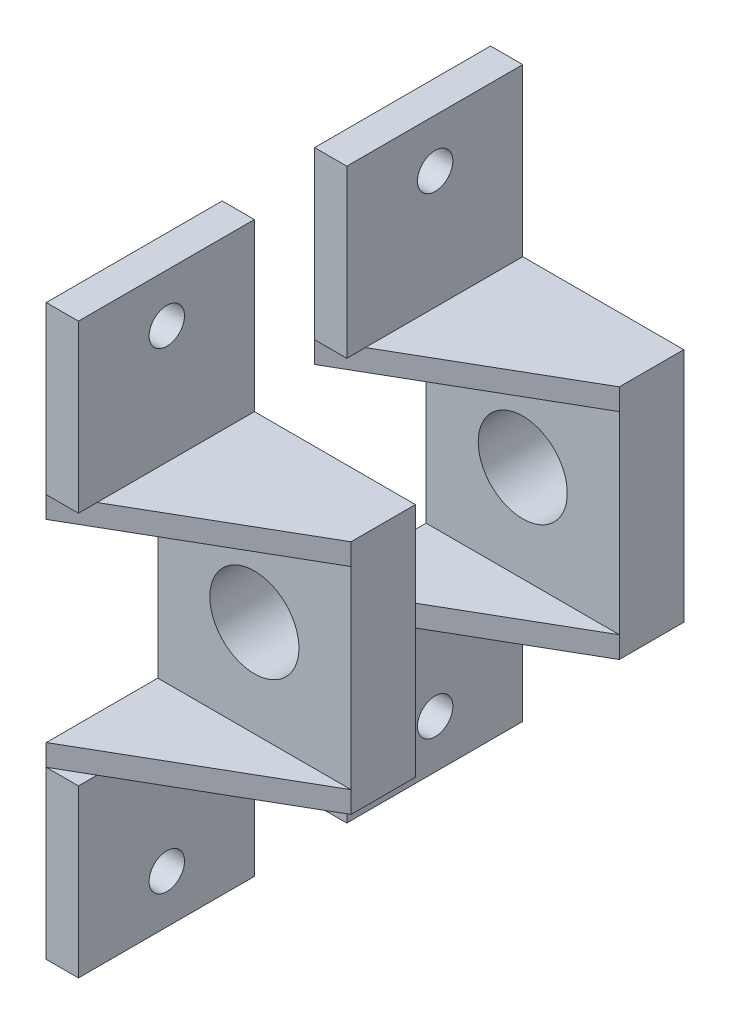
SolidWorks part; units mm, degrees
ref_plane "Alzado" through (0, 0, 0) normal (0, 0, 1) x (1, 0, 0)
ref_plane "Planta" through (0, 0, 0) normal (0, 1, 0) x (1, 0, 0)
ref_plane "Vista lateral" through (0, 0, 0) normal (1, 0, 0) x (0, 0, -1)
sketch "Croquis1" plane through (0, 0, 0) normal (1, 0, 0) x (0, 0, -1)
  line L0 (-1, 0) -> (-1, 12.3829) construction
  line L5 (-124.75, -85.2098) -> (150.75, -85.2098)
  line L6 (-124.75, -85.2098) -> (-124.75, 114.7902)
  line L7 (-124.75, 114.7902) -> (150.75, 114.7902)
  line L8 (150.75, -85.2098) -> (150.75, 114.7902)
  line L9 (-124.75, -85.2098) -> (150.75, 114.7902) construction
  line L10 (-124.75, 114.7902) -> (150.75, -85.2098) construction
  line L11 (93, 15.25) -> (60.5, 15.25)
  line L13 (93, -15.25) -> (60.5, -15.25)
  line L15 (76.75, -14.4007) -> (76.75, -9.0223) construction
  line L16 (-1, 0) -> (8.5392, 0) construction
  line L21 (13, 114.7902) -> (13, 58.1657) construction
  line L35 (13, 14.7902) -> (13, 48) construction
  line L38 (93, 25.25) -> (60.5, 25.25) construction
  line L39 (93, -25.25) -> (60.5, -25.25) construction
  line L40 (-64.5, 25) -> (-64.5, 58) construction
  line L43 (-64.5, 38) -> (77.5, 38)
  line L44 (-64.5, 38) -> (-64.5, 78)
  line L45 (-64.5, 78) -> (77.5, 78)
  line L46 (77.5, 38) -> (77.5, 78)
  line L47 (-73, 78) -> (-73, 38)
  line L48 (-69.5, 78) -> (-69.5, 38)
  line L49 (86, 78) -> (86, 38)
  line L50 (82.5, 78) -> (82.5, 38)
  line L51 (-64.5, -25) -> (-64.5, -58) construction
  line L52 (-124.75, 14.7902) -> (-97.6875, 14.7902) construction
  line L53 (45.5, 17) -> (-48.6148, 17)
  line L54 (45.5, 13.7) -> (-48.6148, 13.7)
  arc A0 (93, -15.25) -> (93, 15.25) centre (93, 0) ccw
  arc A1 (60.5, -15.25) -> (60.5, 15.25) centre (60.5, 0) cw
  circle A2 centre (-64.5, 0) radius 15.25
  circle A5 centre (-64.5, 0) radius 25 construction
  arc A6 (60.5, -25.25) -> (60.5, 25.25) centre (60.5, 0) cw construction
  arc A7 (93, -25.25) -> (93, 25.25) centre (93, 0) ccw construction
  arc A8 (-69.5, 78) -> (-73, 78) centre (-71.25, 78) ccw
  arc A9 (-73, 38) -> (-69.5, 38) centre (-71.25, 38) ccw
  arc A10 (82.5, 38) -> (86, 38) centre (84.25, 38) ccw
  arc A11 (86, 78) -> (82.5, 78) centre (84.25, 78) ccw
  circle A12 centre (138.75, 109.7902) radius 1.75
  circle A13 centre (-112.75, 109.7902) radius 1.75
  circle A14 centre (138.75, -80.2098) radius 1.75
  circle A15 centre (-112.75, -80.2098) radius 1.75
  arc A16 (45.5, 13.7) -> (45.5, 17) centre (45.5, 15.35) ccw
  arc A17 (-48.6148, 17) -> (-48.6148, 13.7) centre (-48.6148, 15.35) ccw
  point P0 (0, 0)
  point P16 (76.75, 15.25)
  point P18 (76.75, -15.25)
  point P22 (108.25, 0)
  point P31 (13, 55.8)
  point P33 (13, 65.25)
  dimension "D5" = 30.5
  dimension "D10" = 30.5
  dimension "D8" = 45
  dimension "D9" = 142
  dimension "D11" = 40
  dimension "D14" = 50
  dimension "D13" = 3.5
  dimension "D17" = 3.5
  dimension "D23" = 3.5
  dimension "D26" = 3.3
  dimension "D29" = 3.3
  dimension "D2" = 200
  dimension "D3" = 125
  dimension "D4" = 64.5
  dimension "D6" = 16.25
  dimension "D7" = 42.5
  dimension "D12" = 20
  dimension "D16" = 33
  dimension "D18" = 40
  dimension "D19" = 5
  dimension "D20" = 2
  dimension "D21" = 5
  dimension "D22" = 33
  dimension "D24" = 12
  dimension "D25" = 5
  dimension "D27" = 21
  dimension "D28" = 15
  dimension "D15" = 10
extrude "Saliente-Extruir1" add sketch "Croquis1" along normal blind 6
ref_plane "Plano4" through (6, 0, 0) normal (1, 0, 0) x (0, 0, -1)
sketch "Croquis2" plane through (6, 0, 0) normal (1, 0, 0) x (0, 0, -1)
  line L1 (8, -11) -> (2, -11)
  line L2 (8, -11) -> (8, 11)
  line L3 (8, 11) -> (2, 11)
  line L4 (2, -11) -> (2, 11)
  line L5 (8, -11) -> (2, 11) construction
  line L6 (8, 11) -> (2, -11) construction
  point P0 (5, 0)
  dimension "D1" = 6
  dimension "D2" = 22
  dimension "D3" = 5
extrude "Saliente-Extruir2" add sketch "Croquis2" along normal blind 18
ref_plane "Plano5" through (0, 11, 0) normal (0, 1, 0) x (1, 0, 0)
sketch "Croquis3" plane through (0, 11, 0) normal (0, 1, 0) x (1, 0, 0)
  line L0 (6, -8.3923) -> (24, 2)
  line L1 (6, -60.9824) -> (6, 60.9824) construction
  line L2 (24, 2) -> (6, 2)
  line L3 (6, 2) -> (6, -8.3923)
  dimension "D1" = 60
extrude "Saliente-Extruir3" add sketch "Croquis3" against normal blind 2
ref_plane "Plano6" through (0, -11, 0) normal (0, -1, 0) x (-1, 0, 0)
sketch "Croquis4" plane through (0, -11, 0) normal (0, -1, 0) x (-1, 0, 0)
  line L0 (-24, 2) -> (-6, -8.3923)
  line L1 (-6, 60.9824) -> (-6, -60.9824) construction
  line L2 (-6, -8.3923) -> (-24, 2) construction
  line L3 (-6, -8.3923) -> (-6, 2)
  line L4 (-24, 2) -> (-6, 2) construction
  line L5 (-6, 2) -> (-24, 2)
extrude "Saliente-Extruir4" add sketch "Croquis4" against normal blind 2
ref_plane "Plano7" through (0, 0, -8) normal (0, 0, -1) x (-1, 0, 0)
sketch "Croquis5" plane through (0, 0, -8) normal (0, 0, -1) x (-1, 0, 0)
  line L2 (-6, 60.9824) -> (-6, -60.9824) construction
  circle A0 centre (-15, 0) radius 4.15
  dimension "D2" = 8.3
  dimension "D1" = 9
extrude "Cortar-Extruir1" cut sketch "Croquis5" against normal up to surface (6 mm away)
pattern_linear "MatrizL1" count 2 spacing 25 along (0, 0, 1) of "Cortar-Extruir1", "Saliente-Extruir4", "Saliente-Extruir3", "Saliente-Extruir2"
ref_plane "Plano8" through (0, 114.7902, 0) normal (0, 1, 0) x (1, 0, 0)
sketch "Croquis11" plane through (6, 0, 0) normal (1, 0, 0) x (0, 0, -1)
  line L0 (-2.25, 114.7902) -> (-2.25, 74.6709) construction
  line L1 (3.3, 114.7902) -> (-3.3, 114.7902) construction
  line L2 (-124.75, 114.7902) -> (-124.75, -85.2098) construction
  dimension "D1" = 122.5
sketch "Croquis19" plane through (6, 0, 0) normal (1, 0, 0) x (0, 0, -1)
  line L0 (-9.4998, -11) -> (9.4998, -11) construction
  line L1 (-8.3923, -11) -> (8, -11)
  line L2 (-8.3923, -11) -> (-8.3923, -26.5)
  line L3 (-8.3923, -26.5) -> (8, -26.5)
  line L4 (8, -11) -> (8, -26.5)
  line L5 (-8.3923, -9) -> (-8.3923, -11) construction
  line L6 (8, -9.9) -> (8, 9.9) construction
  line L7 (0, 0) -> (-12.7396, 0) construction
  line L8 (-17, -11) -> (-17, -26.5)
  line L9 (-33.3923, -26.5) -> (-17, -26.5)
  line L10 (-33.3923, -11) -> (-33.3923, -26.5)
  line L11 (-33.3923, -11) -> (-17, -11)
  line L12 (-17, 26.5) -> (-17, 11)
  line L13 (-33.3923, 11) -> (-17, 11)
  line L14 (-33.3923, 26.5) -> (-33.3923, 11)
  line L15 (-33.3923, 26.5) -> (-17, 26.5)
  line L16 (8, 26.5) -> (8, 11)
  line L17 (-8.3923, 11) -> (8, 11)
  line L18 (-8.3923, 26.5) -> (-8.3923, 11)
  line L19 (-8.3923, 26.5) -> (8, 26.5)
  dimension "D2" = 15.5
  dimension "D3" = 22
  dimension "D1" = 0
  dimension "D5" = 0
  dimension "D6" = 0
  dimension "D7" = 2
  dimension "D8" = 2
extrude "Saliente-Extruir7" add sketch "Croquis19" along normal blind 3
sketch "Croquis20" plane through (6, 0, 0) normal (1, 0, 0) x (0, 0, -1)
  circle A1 centre (-0.1603, -22) radius 1.65
  circle A5 centre (-25.1603, -22) radius 1.65
  circle A6 centre (-25.1603, 22) radius 1.65
  circle A7 centre (-0.1603, 22) radius 1.65
  dimension "D1" = 3.3
  dimension "D3" = 2
  dimension "D2" = 22
  dimension "D4" = 2
extrude "Cortar-Extruir2" cut sketch "Croquis20" against normal through all both and the other way through all
sketch "Croquis22" plane through (0, 0, 0) normal (1, 0, 0) x (0, 0, -1)
  line L0 (-130.95, 14.7902) -> (-130.95, 64.7902)
  line L1 (-55.875, -85.2098) -> (13, -85.2098)
  line L5 (-124.75, 114.7902) -> (-55.875, 114.7902)
  line L6 (-130.95, -85.2098) -> (-130.95, -35.2098)
  line L9 (-124.75, -91.4098) -> (-55.875, -91.4098)
  line L10 (81.875, 114.7902) -> (150.75, 114.7902)
  line L13 (-124.75, -85.2098) -> (-130.95, -85.2098)
  line L16 (13, -91.4098) -> (81.875, -91.4098)
  line L17 (-124.75, -85.2098) -> (-124.75, -91.4098)
  line L18 (-130.95, -91.4098) -> (-130.95, 120.9902) construction
  line L19 (-130.95, -91.4098) -> (156.95, -91.4098) construction
  line L20 (156.95, -91.4098) -> (156.95, 120.9902) construction
  line L21 (-55.875, -85.2098) -> (-55.875, -91.4098)
  line L22 (13, -85.2098) -> (13, -91.4098)
  line L23 (81.875, -85.2098) -> (81.875, -91.4098)
  line L24 (-124.75, -35.2098) -> (-130.95, -35.2098)
  line L25 (-124.75, 14.7902) -> (-130.95, 14.7902)
  line L26 (-124.75, 64.7902) -> (-130.95, 64.7902)
  line L27 (81.875, -85.2098) -> (150.75, -85.2098)
  line L28 (-124.75, -85.2098) -> (150.75, -85.2098) construction
  line L29 (-124.75, -35.2098) -> (-124.75, 14.7902)
  line L30 (-124.75, -85.2098) -> (-124.75, 114.7902) construction
  line L31 (-130.95, 120.9902) -> (156.95, 120.9902) construction
  line L32 (-124.75, 14.7902) -> (-85.721, 14.7902) construction
  line L33 (-124.75, 114.7902) -> (150.75, 114.7902) construction
  line L34 (-55.875, 114.7902) -> (13, 114.7902)
  line L38 (-124.75, 64.7902) -> (-124.75, 114.7902)
  line L39 (13, -85.2098) -> (13, -53.8857) construction
  line L40 (150.75, -85.2098) -> (150.75, 114.7902) construction
  line L41 (150.75, -85.2098) -> (156.95, -85.2098)
  line L42 (156.95, -85.2098) -> (156.95, -35.2098)
  line L43 (150.75, -35.2098) -> (156.95, -35.2098)
  line L44 (150.75, -35.2098) -> (150.75, 14.7902)
  line L45 (150.75, 14.7902) -> (156.95, 14.7902)
  line L46 (156.95, 14.7902) -> (156.95, 64.7902)
  line L47 (150.75, 64.7902) -> (156.95, 64.7902)
  line L48 (150.75, 64.7902) -> (150.75, 114.7902)
  line L49 (13, 114.7902) -> (81.875, 114.7902)
  line L50 (-123.499, 113.3885) -> (144.5637, 113.3885)
  line L51 (-123.499, 113.3885) -> (-123.499, -84.1824)
  line L52 (-123.499, -84.1824) -> (144.5637, -84.1824)
  line L53 (144.5637, 113.3885) -> (144.5637, -84.1824)
  dimension "D4" = 4
  dimension "D5" = 68.875
  dimension "D7" = 50
  dimension "D3" = 6.2
  dimension "D6" = 4
extrude "Saliente-Extruir9" add sketch "Croquis22" along normal blind 6
sketch "Croquis23" plane through (0, 0, -8) normal (0, 0, -1) x (-1, 0, 0)
  line L0 (-6, 60.9824) -> (-6, -60.9824) construction
  line L1 (-33.89, 25.1309) -> (-6, 25.1309)
  line L2 (-33.89, 25.1309) -> (-33.89, -23.7284)
  line L3 (-33.89, -23.7284) -> (-6, -23.7284)
  line L4 (-6, 25.1309) -> (-6, -23.7284)
sketch "Croquis24" plane through (6, 0, 0) normal (1, 0, 0) x (0, 0, -1)
  line L1 (-152.5218, 125.1127) -> (172.3723, 125.1127)
  line L2 (-152.5218, 125.1127) -> (-152.5218, -100.0242)
  line L3 (-152.5218, -100.0242) -> (172.3723, -100.0242)
  line L4 (172.3723, 125.1127) -> (172.3723, -100.0242)
extrude "Cortar-Extruir3" cut sketch "Croquis24" against normal through all
sketch "Croquis25" plane through (6, 0, 0) normal (1, 0, 0) x (0, 0, -1)
  line L0 (8, 26.5) -> (-8.3923, 26.5) construction
  line L1 (1.4274, 19.25) -> (3.0151, 22)
  line L2 (3.0151, 22) -> (1.4274, 24.75)
  line L3 (1.4274, 24.75) -> (-1.748, 24.75)
  line L4 (-1.748, 24.75) -> (-3.3357, 22)
  line L5 (-3.3357, 22) -> (-1.748, 19.25)
  line L6 (-1.748, 19.25) -> (1.4274, 19.25)
  line L7 (-23.5726, 24.75) -> (-26.748, 24.75)
  line L8 (-26.748, 24.75) -> (-28.3357, 22)
  line L9 (-28.3357, 22) -> (-26.748, 19.25)
  line L10 (-26.748, 19.25) -> (-23.5726, 19.25)
  line L11 (-23.5726, 19.25) -> (-21.9849, 22)
  line L12 (-21.9849, 22) -> (-23.5726, 24.75)
  line L13 (-23.5726, -19.25) -> (-26.748, -19.25)
  line L14 (-26.748, -19.25) -> (-28.3357, -22)
  line L15 (-28.3357, -22) -> (-26.748, -24.75)
  line L16 (-26.748, -24.75) -> (-23.5726, -24.75)
  line L17 (-23.5726, -24.75) -> (-21.9849, -22)
  line L18 (-21.9849, -22) -> (-23.5726, -19.25)
  line L19 (1.4274, -19.25) -> (-1.748, -19.25)
  line L20 (-1.748, -19.25) -> (-3.3357, -22)
  line L21 (-3.3357, -22) -> (-1.748, -24.75)
  line L22 (-1.748, -24.75) -> (1.4274, -24.75)
  line L23 (1.4274, -24.75) -> (3.0151, -22)
  line L24 (3.0151, -22) -> (1.4274, -19.25)
  circle A0 centre (-0.1603, 22) radius 2.75 construction
  circle A1 centre (-0.1603, 22) radius 1.65
  circle A2 centre (-25.1603, 22) radius 1.65
  circle A3 centre (-25.1603, -22) radius 1.65
  circle A4 centre (-0.1603, -22) radius 1.65
  dimension "D2" = 3.3
  dimension "D1" = 5.5
  dimension "D3" = 2
  dimension "D4" = 2
equation "\"ancho\"= 6"
equation "\"D1@Saliente-Extruir1\"=\"ancho\""
